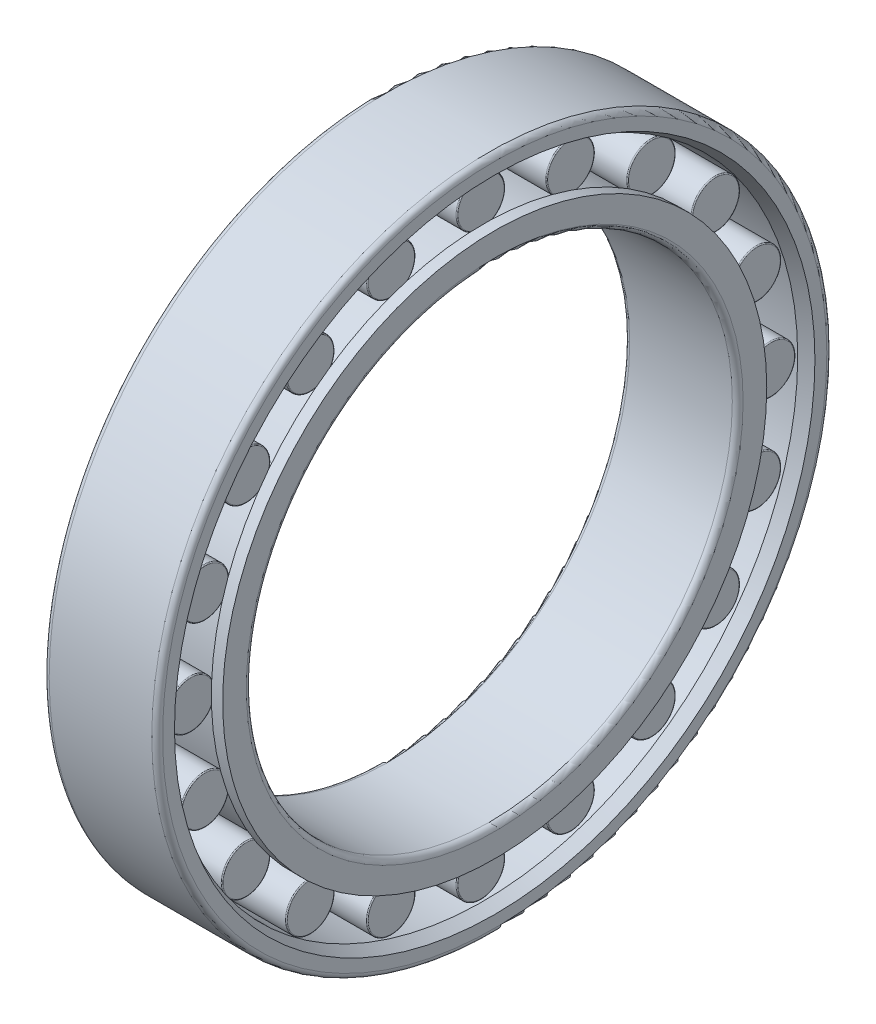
SolidWorks part; units mm, degrees
ref_plane "Plane1" through (0, 0, 0) normal (0, 0, 1) x (1, 0, 0)
ref_plane "Plane2" through (0, 0, 0) normal (0, 1, 0) x (1, 0, 0)
ref_plane "Plane3" through (0, 0, 0) normal (1, 0, 0) x (0, 0, -1)
other "Configuration Table"
sketch "Clipboard" plane through (0, 0, 0) normal (0, 0, 1) x (1, 0, 0)
  line L0 (-10, 0) -> (10, 0) construction
  line L1 (0, 0) -> (185.2698, -67.4327)
  line L2 (0, 0) -> (101.017, 36.7672)
  line L3 (0, 0) -> (218.798, -79.636)
  line L4 (0, 0) -> (-22.3471, -0.7804)
sketch "OutRacSke" plane through (0, 0, 0) normal (0, 0, 1) x (1, 0, 0)
  line L0 (16.8, 116.42) -> (21, 118.5944)
  line L1 (-21, 118.5944) -> (-21, 123)
  line L2 (-19, 125) -> (19, 125)
  line L3 (21, 123) -> (21, 118.5944)
  line L4 (-16.8, 116.42) -> (-21, 118.5944)
  line L6 (16.8, 116.42) -> (-16.8, 116.42)
  line L8 (-90, 0) -> (90, 0) construction
  arc A0 (-21, 123) -> (-19, 125) centre (-19, 123) cw
  arc A1 (19, 125) -> (21, 123) centre (19, 123) cw
revolve "OuterRace" add sketch "OutRacSke" angle 360 about L8
sketch "RolDetSke" plane through (0, 0, 0) normal (0, 0, 1) x (1, 0, 0)
  line L0 (-15.96, 116.068) -> (-15.96, 107.5)
  line L1 (-15.96, 107.5) -> (15.96, 107.5)
  line L2 (15.96, 107.5) -> (15.96, 116.068)
  line L3 (15.603, 116.425) -> (-15.603, 116.425)
  line L4 (-33.6, 107.5) -> (33.6, 107.5) construction
  arc A0 (15.96, 116.068) -> (15.603, 116.425) centre (15.603, 116.068) ccw
  arc A1 (-15.603, 116.425) -> (-15.96, 116.068) centre (-15.603, 116.068) ccw
revolve "RollerDetailed" add sketch "RolDetSke" angle 360 about L4
ref_axis "Axis1" through (-50, 0, 0) along (1, 0, 0)
sketch "RolSimSke" plane through (0, 101.6, 0) normal (0, 0, 1) x (1, 0, 0)
  line L0 (-15.96, 14.468) -> (-15.96, -2.668)
  line L1 (25.4, -101.6) -> (-25.4, -101.6) construction
  line L2 (15.96, -2.668) -> (15.96, 14.468)
  line L3 (15.603, 14.825) -> (-15.603, 14.825)
  line L5 (15.603, -3.025) -> (-15.603, -3.025)
  arc A0 (15.96, 14.468) -> (15.603, 14.825) centre (15.603, 14.468) ccw
  arc A1 (-15.603, 14.825) -> (-15.96, 14.468) centre (-15.603, 14.468) ccw
  arc A2 (15.96, -2.668) -> (15.603, -3.025) centre (15.603, -2.668) cw
  arc A3 (-15.603, -3.025) -> (-15.96, -2.668) centre (-15.603, -2.668) cw
revolve "RollersSimplified" [suppressed] add sketch "RolSimSke" angle 360 about L1
sketch "InsRacSke" plane through (0, 0, 0) normal (0, 0, 1) x (1, 0, 0)
  line L0 (16.8, 98.58) -> (16.8, 100.7544)
  line L1 (-21, 100.7544) -> (-21, 92)
  line L2 (-19, 90) -> (19, 90)
  line L3 (21, 92) -> (21, 100.7544)
  line L4 (16.8, 100.7544) -> (21, 100.7544)
  line L5 (16.8, 98.58) -> (-16.8, 98.58)
  line L6 (-90, 0) -> (90, 0) construction
  line L8 (-16.8, 98.58) -> (-16.8, 100.7544)
  line L9 (-16.8, 100.7544) -> (-21, 100.7544)
  arc A0 (-21, 92) -> (-19, 90) centre (-19, 92) ccw
  arc A1 (19, 90) -> (21, 92) centre (19, 92) ccw
revolve "InnerRace" add sketch "InsRacSke" angle 360 about L6
pattern_circular "RollersDetailed" count 20 every 18 about axis through (-50, 0, 0) along (1, 0, 0) of "RollerDetailed"
sketch "CagSpiSke" plane through (0, 0, 0) normal (0, 0, 1) x (1, 0, 0)
  line L0 (18.9, 105.2687) -> (18.9, 109.7313)
  line L1 (18.9, 109.7313) -> (-18.9, 109.7313)
  line L2 (-18.9, 109.7313) -> (-18.9, 105.2687)
  line L3 (-18.9, 105.2687) -> (18.9, 105.2687)
  line L4 (-90, 0) -> (90, 0) construction
revolve "CageSpine" [suppressed] add sketch "CagSpiSke" angle 360 about L4
equation "\"CLdia@Clipboard\" =  ( \"Race_OD@Clipboard\" + \"Race_ID@Clipboard\" )  / 4"
equation "\"Race_OD@OutRacSke\" = \"Race_OD@Clipboard\""
equation "\"halfCylLen@OutRacSke\" = \"Cyl_Len@OutRacSke\" / 2"
equation "\"RolCLRad@RolDetSke\" = \"CLdia@Clipboard\""
equation "\"Roller_diameter@RolDetSke\" =  ( \"Race_OD@Clipboard\" - \"Race_ID@Clipboard\" )  / 2 + .01"
equation "\"Roller_diameter@RolSimSke\" =  ( \"Race_OD@Clipboard\" - \"Race_ID@Clipboard\" )  / 2 + .01"
equation "\"radius@RolDetSke\" = \"Roller_diameter@RolDetSke\" / 50"
equation "\"Length@RolDetSke\" = \"Cyl_Len@OutRacSke\" * .95"
equation "\"halfLength@RolDetSke\" = \"Length@RolDetSke\" / 2"
equation "\"thickness@CagSpiSke\"  = \"Roller_diameter@RolDetSke\" * .25"
equation "\"Cag_IR@CagSpiSke\" =  \"RolCLRad@RolDetSke\" * 2 - \"thickness@CagSpiSke\""
equation "\"Rol_Length@RolSimSke\" = \"Cyl_Len@InsRacSke\" * .95"
equation "\"halfLength@RolSimSke\" = \"Rol_Length@RolSimSke\" / 2"
equation "\"radius@RolSimSke\" = \"radius@RolDetSke\""
equation "\"D1@RolSimSke\" = \"CLdia@Clipboard\" -  ( \"Roller_diameter@RolSimSke\" / 2 ) "
equation "\"Max_count@Clipboard\" = int( 3.14159265 / atn(( \"Roller_diameter@RolDetSke\" / 2) / sqr( \"RolCLRad@RolDetSke\"  *  \"RolCLRad@RolDetSke\" - ( \"Roller_diameter@RolDetSke\" / 2) *  ( \"Roller_diameter@RolDetS"
equation "\"Max_count@Clipboard\" = ((sgn( \"Max_count@Clipboard\" - \"Count@Clipboard\" )-1)*( \"Max_count@Clipboard\" - \"Count@Clipboard\" ))/-2+ \"Count@Clipboard\""
equation "\"Count@RollersDetailed\" = int( \"Show_count@Clipboard\" ) "
equation "\"Count@RollersDetailed\" = ((sgn( \"Count@RollersDetailed\" - \"Max_count@Clipboard\" )-1)*( \"Count@RollersDetailed\" - \"Max_count@Clipboard\" ))/-2+ \"Max_count@Clipboard\""
equation "\"Count@RollersDetailed\" = ((sgn( \"Count@RollersDetailed\" - \"Min_count@Clipboard\" )+1)*( \"Count@RollersDetailed\" - \"Min_count@Clipboard\"))/2 +\"Min_count@Clipboard\""
equation "\"Angle@RollersDetailed\" = 360.0 / \"Max_count@Clipboard\""
equation "\"radius@InsRacSke\" = \"radius@OutRacSke\""
equation "\"groove_dp@InsRacSke\" = \"groove_dp@OutRacSke\""
equation "\"Width@InsRacSke\" = \"Width@OutRacSke\""
equation "\"halfWidth@OutRacSke\" = \"Width@OutRacSke\" / 2"
equation "\"halfWidth@InsRacSke\" = \"Width@InsRacSke\" / 2"
equation "\"Race_ID@InsRacSke\" = \"Race_ID@Clipboard\""
equation "\"Cyl_Len@InsRacSke\" = \"Cyl_Len@OutRacSke\""
equation "\"halfCylLen@InsRacSke\" = \"Cyl_Len@InsRacSke\" / 2"
equation "\"Angle@CageSpine\" =  \"Angle@RollersDetailed\" * ( \"Count@RollersDetailed\" -1 + int( \"Count@RollersDetailed\" / \"Max_count@Clipboard\" ) )  + 0.001 -  int( \"Count@RollersDetailed\" / \"Max_count@Clipboard\" "
equation "\"Angle@CageSpine\" =  \"Angle@CageSpine\" * int( \"Min_count@Clipboard\" / 2) + int(1 / \"Min_count@Clipboard\")  * 0.001"
equation "\"width@CagSpiSke\" =   ( \"Width@InsRacSke\" + \"Cyl_Len@InsRacSke\" )  / 2"
equation "\"halfwidth@CagSpiSke\" = \"width@CagSpiSke\" / 2"
